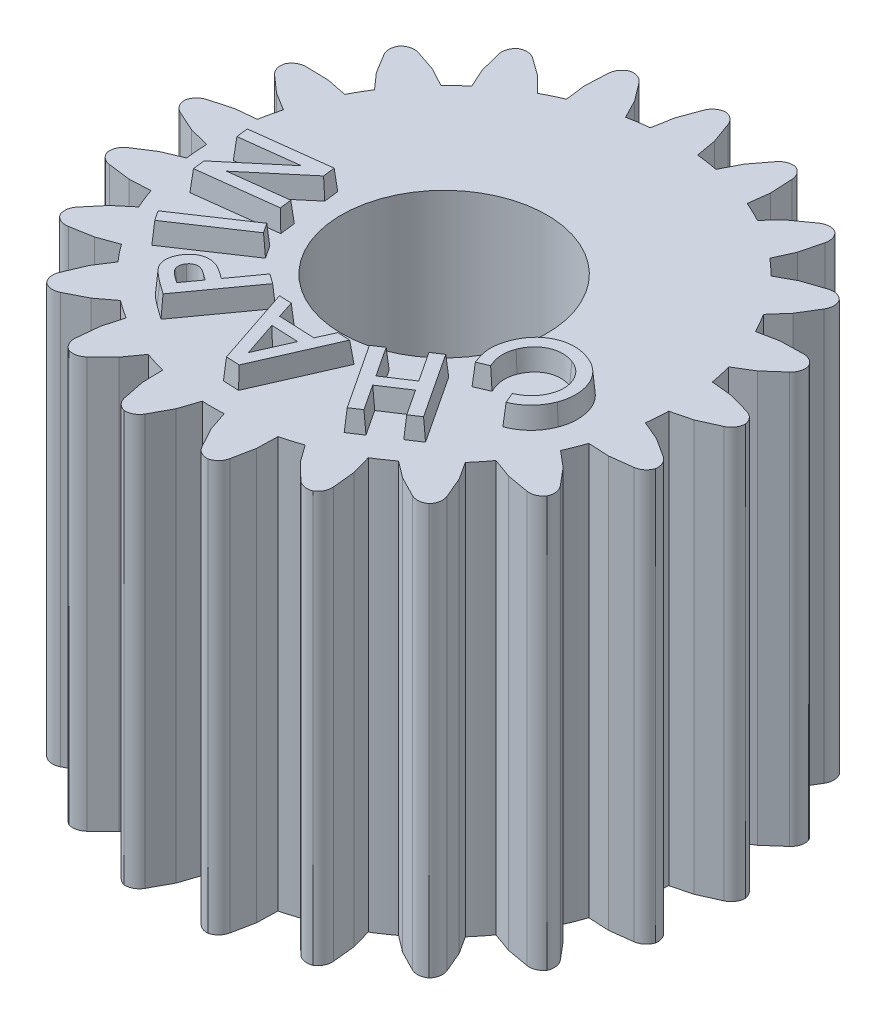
SolidWorks part; units mm, degrees
ref_plane "Front Plane" through (0, 0, 0) normal (0, 0, 1) x (1, 0, 0)
ref_plane "Top Plane" through (0, 0, 0) normal (0, 1, 0) x (1, 0, 0)
ref_plane "Right Plane" through (0, 0, 0) normal (1, 0, 0) x (0, 0, -1)
sketch "Sketch1" plane through (0, 0, 0) normal (0, 1, 0) x (1, 0, 0)
  circle A0 centre (0, 0) radius 28.575
  dimension "D1" = 57.15
extrude "Boss-Extrude1" add sketch "Sketch1" along normal blind 50.8
sketch "Sketch2" plane through (0, 50.8, 0) normal (0, 1, 0) x (1, 0, 0)
  line L0 (-2.921, 28.4253) -> (2.921, 28.4253)
  line L1 (2.921, 28.4253) -> (2.4731, 30.9653)
  line L2 (2.4731, 30.9653) -> (1.0864, 34.7753)
  line L3 (1.0864, 34.7753) -> (-1.0864, 34.7753)
  line L4 (-1.0864, 34.7753) -> (-2.4731, 30.9653)
  line L5 (-2.4731, 30.9653) -> (-2.921, 28.4253)
  circle A0 centre (0, 0) radius 28.575 construction
  dimension "D1" = 2.54
  dimension "D2" = 3.81
  dimension "D3" = 5.842
  dimension "D4" = 80
  dimension "D5" = 110
extrude "Boss-Extrude2" add sketch "Sketch2" against normal blind 50.8
fillet "Fillet1" radius 1.778 2 edges at (1.0864, 25.4, -34.7753) (-1.0864, 25.4, -34.7753)
pattern_circular "CirPattern1" count 21 over 360 about axis through (0, 0, 0) along (0, 1, 0) of "Fillet1", "Boss-Extrude2"
sketch "Sketch3" plane through (0, 50.8, 0) normal (0, 1, 0) x (1, 0, 0)
  circle A0 centre (0, 0) radius 12.7
  dimension "D1" = 25.4
extrude "Cut-Extrude1" cut sketch "Sketch3" against normal up to vertex
sketch "Sketch4" plane through (0, 50.8, 0) normal (0, 1, 0) x (1, 0, 0)
  circle A0 centre (0, 0) radius 15.875 construction
  circle A1 centre (0, 0) radius 12.7 construction
  arc A2 (-9.7016, -26.8777) -> (-7.1249, -27.6725) centre (0, 0) ccw construction
  text T0 "<b>CHAPIN</b>" font "Century Gothic" height 10.16
  dimension "D1" = 12.7
  dimension "D2" = 3.175
extrude "Boss-Extrude3" add sketch "Sketch4" along normal blind 2.54 draft 5
